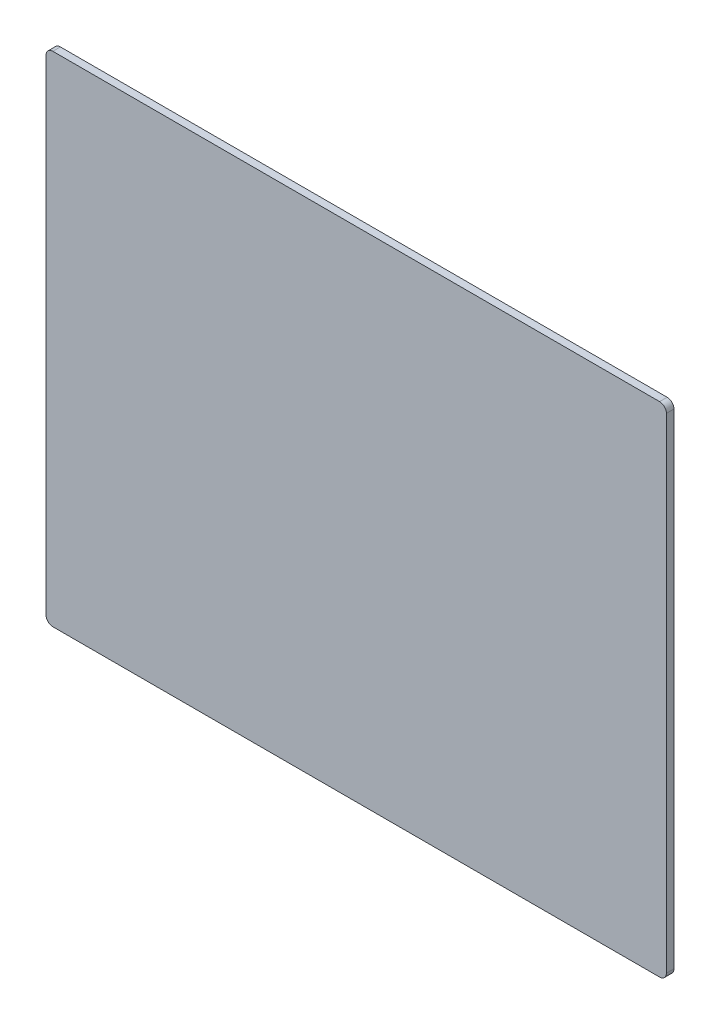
SolidWorks part; units mm, degrees
ref_plane "Front Plane" through (0, 0, 0) normal (0, 0, 1) x (1, 0, 0)
ref_plane "Top Plane" through (0, 0, 0) normal (0, 1, 0) x (1, 0, 0)
ref_plane "Right Plane" through (0, 0, 0) normal (1, 0, 0) x (0, 0, -1)
sketch "Sketch1" plane through (0, 0, 0) normal (0, 0, 1) x (1, 0, 0)
  line L3 (502.5509, 172.4609) -> (502.5509, 9.5402)
  line L4 (296.3435, 7.2542) -> (500.2649, 7.2542)
  line L5 (294.0575, 172.4609) -> (294.0575, 9.5402)
  line L6 (500.2649, 174.7469) -> (296.3435, 174.7469)
  arc A4 (502.5509, 9.5402) -> (500.2649, 7.2542) centre (500.2649, 9.5402) cw
  arc A5 (296.3435, 7.2542) -> (294.0575, 9.5402) centre (296.3435, 9.5402) cw
  arc A6 (294.0575, 172.4609) -> (296.3435, 174.7469) centre (296.3435, 172.4609) cw
  arc A7 (502.5509, 172.4609) -> (500.2649, 174.7469) centre (500.2649, 172.4609) ccw
extrude "Boss-Extrude1" add sketch "Sketch1" along normal blind 2.54
